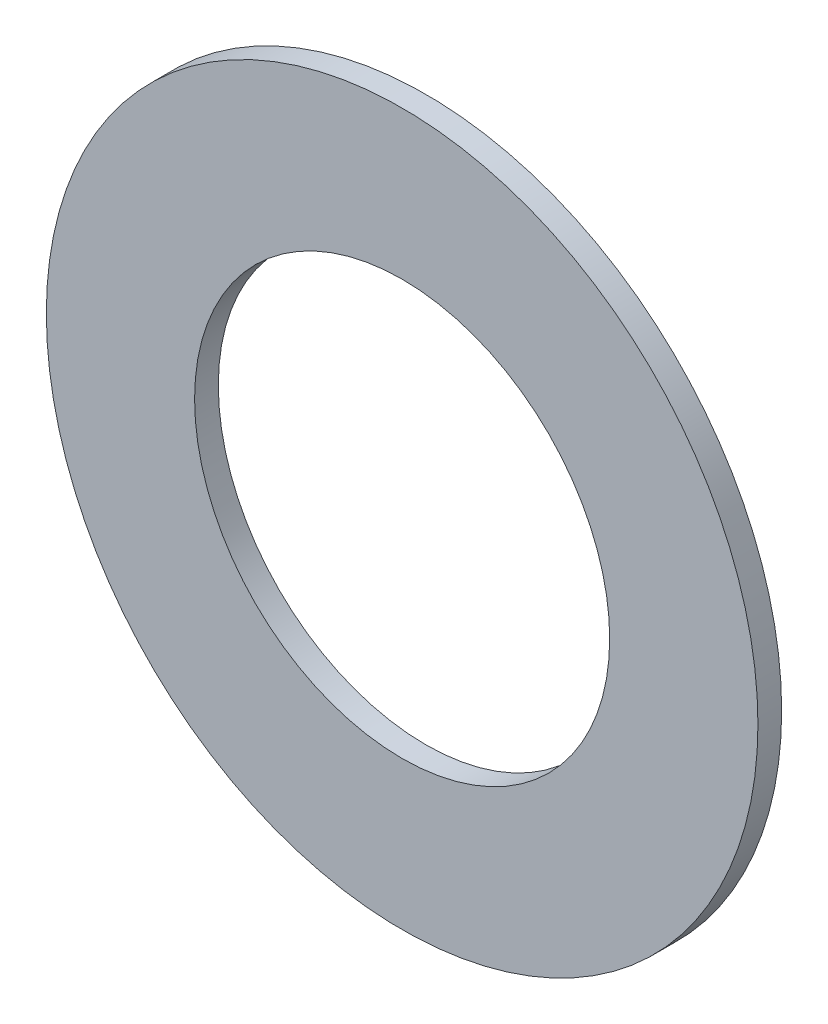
SolidWorks part; units mm, degrees
ref_plane "Front" through (0, 0, 0) normal (0, 0, 1) x (1, 0, 0)
ref_plane "Top" through (0, 0, 0) normal (0, 1, 0) x (1, 0, 0)
ref_plane "Right" through (0, 0, 0) normal (1, 0, 0) x (0, 0, -1)
sketch "Sketch1" plane through (0, 0, 0) normal (0, 0, 1) x (1, 0, 0)
  circle A0 centre (0, 0) radius 6
extrude "Boss-Extrude1" add sketch "Sketch1" along normal blind 0.4
sketch "Sketch2" plane through (0, 0, 0.4) normal (0, 0, 1) x (1, 0, 0)
  circle A0 centre (0, 0) radius 3.5
extrude "Cut-Extrude1" cut sketch "Sketch2" against normal up to surface (0.4 mm away)
